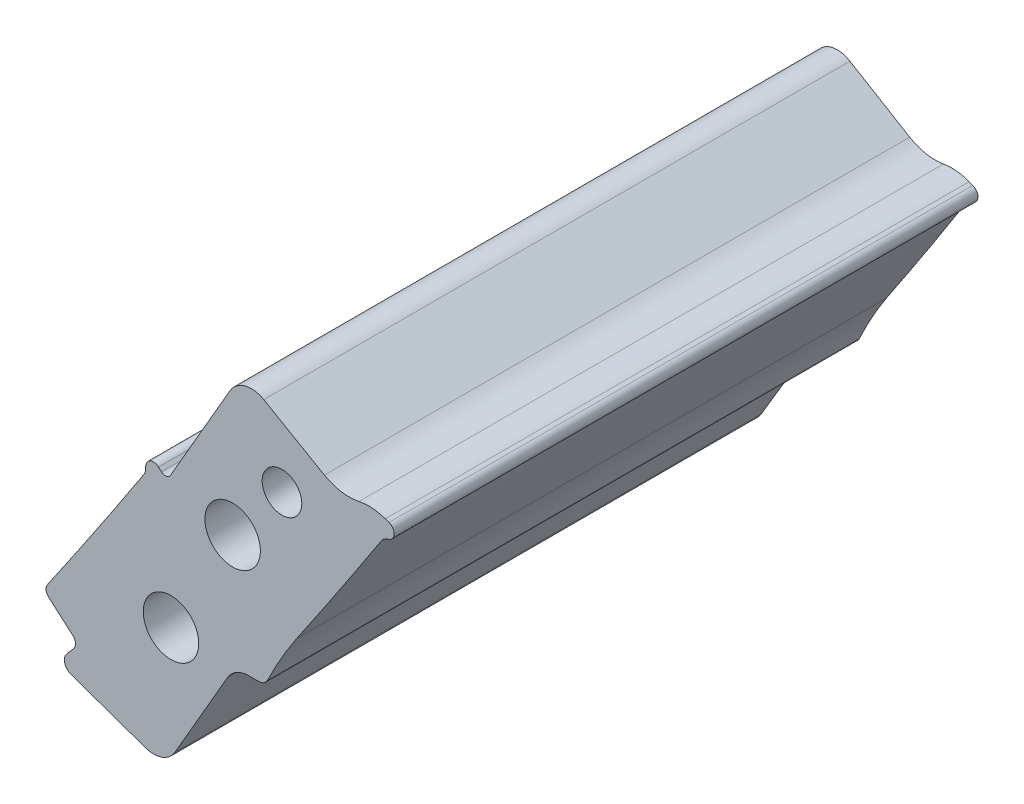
SolidWorks part; units mm, degrees
other "<QU250515L_Punch5[Mounted in the strip]>-<Punch Extrude>"
ref_plane "Front" through (0, 0, 0) normal (0, 0, 1) x (1, 0, 0)
ref_plane "Top" through (0, 0, 0) normal (0, 1, 0) x (1, 0, 0)
ref_plane "Right" through (0, 0, 0) normal (1, 0, 0) x (0, 0, -1)
inserted part "24051_Punch5[Mounted in the strip]1"
hole_wizard "Hole1" positions "Point_Sketch" profile "Profil_Sketch" legacy
sketch "Point_Sketch" plane through (-947.8431, 26.335, 71.9582) normal (0, 0, -1) x (1, 0, 0)
  point P0 (12.8691, 0.935)
sketch "Profil_Sketch" plane through (-934.974, 25.4, 71.9582) normal (1, 0, 0) x (0, -1, 0)
  line L0 (0, 0) -> (0, 76.9249)
  line L1 (0, 76.9249) -> (1.2065, 76.2)
  line L2 (1.2065, 76.2) -> (1.2065, 41.275)
  line L3 (1.2065, 41.275) -> (2.5527, 41.275)
  line L4 (2.5527, 0) -> (0, 0)
  line L5 (0, -11.3109) -> (0, 121.1557) construction
  line L6 (0, 76.9249) -> (-1.2065, 76.2) construction
  line L7 (2.5527, 41.275) -> (2.5527, 0)
  dimension "Depth" = 76.2
  dimension "Drill Angle" = 118
  dimension "Diameter" = 2.413
  dimension "L1" = 41.275
other "usin_TR460<1>"
hole_wizard "Hole11" positions "Point_Sketch1" profile "Profil_Sketch1" counterbore size "1/4" standard "ANSI Inch"
sketch "Point_Sketch1" plane through (-926.9309, 18.3975, -4.2418) normal (0, 0, 1) x (-1, 0, 0)
  point P0 (14.3931, 0.935)
  point P2 (22.3306, 15.2225)
sketch "Profil_Sketch1" plane through (-941.324, 17.4625, -4.2418) normal (1, 0, 0) x (0, 1, 0)
  line L0 (0, 0) -> (0, 76.2)
  line L1 (0, 76.2) -> (3.5687, 76.2)
  line L3 (3.5687, 76.2) -> (3.5687, 22.352)
  line L4 (3.5687, 22.352) -> (5.3594, 22.352)
  line L5 (5.3594, 22.352) -> (5.3594, 0)
  line L7 (5.3594, 0) -> (0, 0)
  line L11 (0, -6.35) -> (0, 107.95) construction
  dimension "Diameter" = 7.1374
  dimension "Thru Hole Depth" = 76.2
  dimension "L1" = 22.352
other "usin_LS160_.25-20x3-SHCS<1>"
sketch "Sketch1" plane through (0, 0, -4.2418) normal (0, 0, -1) x (-1, 0, 0)
  line L0 (937.9751, 4.0811) -> (951.5179, 19.5121) construction
  arc A0 (936.8328, 3.526) -> (937.9751, 2.8111) centre (937.9751, 4.0811) ccw construction
  arc A1 (952.515, 19.4364) -> (950.8602, 20.2654) centre (951.5179, 19.5121) ccw construction
  point P9 (944.7465, 11.7966)
ref_plane "Plane1" through (-944.7465, 11.7966, -4.2418) normal (-0.6596, 0.7516, 0) x (0.7516, 0.6596, 0)
sketch "Sketch3" plane through (-944.7465, 11.7966, -4.2418) normal (-0.6596, 0.7516, 0) x (0.7516, 0.6596, 0)
  line L0 (-0.0194, -0.0008) -> (-26.6085, -1.0657)
  line L1 (0.0195, -0.0007) -> (29.1323, -1.0657)
  line L2 (0, 0) -> (0, 25.8673) construction
  line L3 (29.1323, -76.2) -> (27.6725, -76.2)
  line L4 (29.1323, -76.2) -> (27.6725, -76.2) construction
  line L5 (27.6725, -76.2) -> (26.5591, -76.2)
  line L6 (27.6725, -76.2) -> (26.5591, -76.2) construction
  line L7 (26.5591, -76.2) -> (7.5756, -76.2)
  line L8 (26.5591, -76.2) -> (7.5756, -76.2) construction
  line L9 (7.5756, -76.2) -> (0.4924, -76.2)
  line L10 (7.5756, -76.2) -> (0.4924, -76.2) construction
  line L11 (0.4924, -76.2) -> (-0.8377, -76.2)
  line L12 (0.4924, -76.2) -> (-0.8377, -76.2) construction
  line L13 (-0.8377, -76.2) -> (-1.7922, -76.2)
  line L14 (-0.8377, -76.2) -> (-1.7922, -76.2) construction
  line L15 (-1.7922, -76.2) -> (-4.906, -76.2)
  line L16 (-1.7922, -76.2) -> (-4.906, -76.2) construction
  line L17 (-4.906, -76.2) -> (-17.679, -76.2)
  line L18 (-4.906, -76.2) -> (-17.679, -76.2) construction
  line L19 (-17.679, -76.2) -> (-21.4669, -76.2)
  line L20 (-17.679, -76.2) -> (-21.4669, -76.2) construction
  line L21 (-21.4669, -76.2) -> (-26.4459, -76.2)
  line L22 (-21.4669, -76.2) -> (-26.4459, -76.2) construction
  line L23 (-26.4459, -76.2) -> (-26.6085, -76.2)
  line L24 (-26.4459, -76.2) -> (-26.6085, -76.2) construction
  line L25 (-26.6085, -76.2) -> (-26.6085, 0)
  line L26 (-26.6085, -76.2) -> (-26.6085, 0) construction
  line L27 (-26.6085, 0) -> (-26.4459, 0)
  line L28 (-26.6085, 0) -> (-26.4459, 0) construction
  line L29 (-26.4459, 0) -> (-21.4669, 0)
  line L30 (-26.4459, 0) -> (-21.4669, 0) construction
  line L31 (-21.4669, 0) -> (-17.679, 0)
  line L32 (-21.4669, 0) -> (-17.679, 0) construction
  line L33 (-17.679, 0) -> (-4.906, 0)
  line L34 (-17.679, 0) -> (-4.906, 0) construction
  line L35 (-4.906, 0) -> (-1.7922, 0)
  line L36 (-4.906, 0) -> (-1.7922, 0) construction
  line L37 (-1.7922, 0) -> (-0.8377, 0)
  line L38 (-1.7922, 0) -> (-0.8377, 0) construction
  line L39 (-0.8377, 0) -> (0.4924, 0)
  line L40 (-0.8377, 0) -> (0.4924, 0) construction
  line L41 (0.4924, 0) -> (7.5756, 0)
  line L42 (0.4924, 0) -> (7.5756, 0) construction
  line L43 (7.5756, 0) -> (26.5591, 0)
  line L44 (7.5756, 0) -> (26.5591, 0) construction
  line L45 (26.5591, 0) -> (27.6725, 0)
  line L46 (26.5591, 0) -> (27.6725, 0) construction
  line L47 (27.6725, 0) -> (29.1323, 0)
  line L48 (27.6725, 0) -> (29.1323, 0) construction
  line L49 (29.1323, 0) -> (29.1323, -76.2)
  line L50 (29.1323, 0) -> (29.1323, -76.2) construction
  arc A0 (0.0195, -0.0007) -> (-0.0194, -0.0008) centre (0.0009, -0.5084) ccw
  point P36 (0, 0)
  dimension "D2" = 0.508
  dimension "D1" = 1.0657
extrude "Shear Cut" cut sketch "Sketch3" against normal through all and the other way through all
